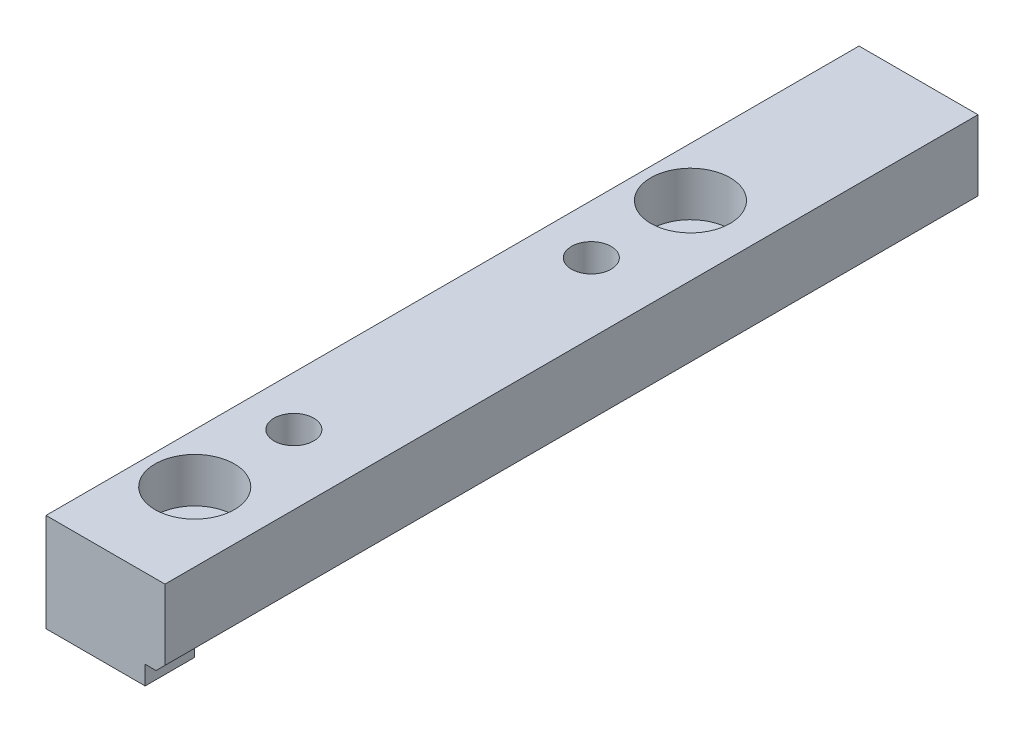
SolidWorks part; units mm, degrees
ref_plane "前视基准面" through (0, 0, 0) normal (0, 0, 1) x (1, 0, 0)
ref_plane "上视基准面" through (0, 0, 0) normal (0, 1, 0) x (1, 0, 0)
ref_plane "右视基准面" through (0, 0, 0) normal (1, 0, 0) x (0, 0, -1)
sketch "草图1" plane through (0, 0, 0) normal (0, 0, 1) x (1, 0, 0)
  line L0 (0, 0) -> (0, 9.9)
  line L1 (10, 0) -> (10, 1.9)
  line L2 (12, 2.8) -> (12, 9.9)
  line L3 (10, 1.9) -> (11.1, 1.9)
  line L4 (0, 0) -> (10, 0)
  line L5 (0, 9.9) -> (12, 9.9)
  line L6 (11.1, 1.9) -> (12, 2.8)
extrude "凸台-拉伸1" add sketch "草图1" along normal blind 82
sketch "草图2" plane through (12, 0, 0) normal (1, 0, 0) x (0, 0, -1)
  line L0 (-77, 1.9) -> (0, 1.9)
  line L1 (-82, 9.9) -> (0, 9.9)
  line L2 (-82, 0) -> (-77, 0)
  line L3 (0, 1.9) -> (0, 9.9)
  line L4 (-82, 0) -> (-82, 9.9)
  line L5 (-77, 0) -> (-77, 1.9)
extrude "切除-拉伸1" cut sketch "草图2" against normal blind 82 flip side to cut
sketch "草图3" plane through (0, 9.9, 0) normal (0, 1, 0) x (1, 0, 0)
  circle A0 centre (5, -22) radius 2.25
  circle A1 centre (5, -72) radius 2.25
extrude "切除-拉伸2" cut sketch "草图3" against normal blind 82
sketch "草图4" plane through (0, 9.9, 0) normal (0, 1, 0) x (1, 0, 0)
  circle A0 centre (5, -22) radius 4
  circle A1 centre (5, -72) radius 4
extrude "切除-拉伸3" cut sketch "草图4" against normal blind 4.5
sketch "草图5" plane through (0, 9.9, 0) normal (0, 1, 0) x (1, 0, 0)
  circle A0 centre (5, -32) radius 2
  circle A1 centre (5, -62) radius 2
extrude "切除-拉伸4" cut sketch "草图5" against normal through all
